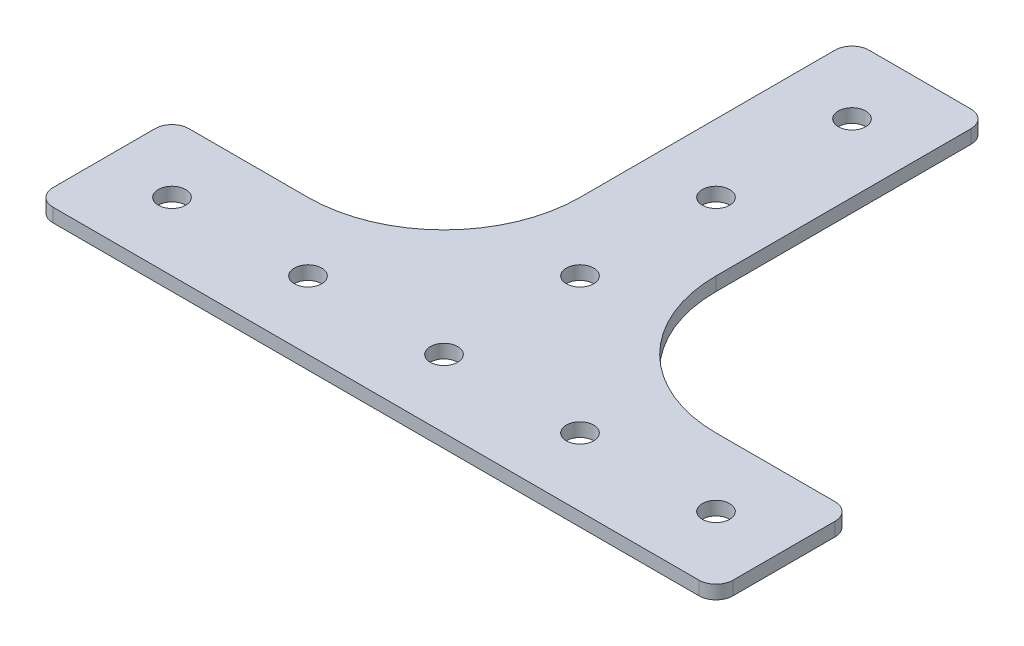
SolidWorks part; units mm, degrees
ref_plane "Front Plane" through (0, 0, 0) normal (0, 0, 1) x (1, 0, 0)
ref_plane "Top Plane" through (0, 0, 0) normal (0, 1, 0) x (1, 0, 0)
ref_plane "Right Plane" through (0, 0, 0) normal (1, 0, 0) x (0, 0, -1)
sketch "Sketch1" plane through (0, 0, 0) normal (0, 1, 0) x (1, 0, 0)
  line L0 (-63.5, 0) -> (63.5, 0)
  line L1 (-63.5, 0) -> (-63.5, 25.4)
  line L2 (-63.5, 25.4) -> (-12.7, 25.4)
  line L3 (-12.7, 25.4) -> (-12.7, 101.6)
  line L4 (-12.7, 101.6) -> (12.7, 101.6)
  line L5 (12.7, 101.6) -> (12.7, 25.4)
  line L6 (12.7, 25.4) -> (63.5, 25.4)
  line L7 (63.5, 25.4) -> (63.5, 0)
  point P4 (0, 0)
  dimension "D1" = 25.4
  dimension "D2" = 127
  dimension "D3" = 101.6
extrude "Boss-Extrude1" add sketch "Sketch1" along normal blind 2.54
fillet "Fillet1" radius 3.175 6 edges at (-63.5, 1.27, -25.4) (-12.7, 1.27, -101.6) (12.7, 1.27, -101.6) (63.5, 1.27, -25.4) (63.5, 1.27, 0) (-63.5, 1.27, 0)
hole_wizard "#7 (0.201) Diameter Hole1" positions "Sketch3" profile "Sketch4" hole size "#7" standard "ANSI Inch"
sketch "Sketch3" plane through (0, 2.54, 0) normal (0, 1, 0) x (1, 0, 0)
  line L0 (-60.325, 0) -> (60.325, 0) construction
  line L1 (60.325, 25.4) -> (12.7, 25.4) construction
  point P0 (0, 12.7)
  point P2 (25.4, 12.7)
  point P4 (50.8, 12.7)
  point P6 (-25.4, 12.7)
  point P8 (-50.8, 12.7)
  point P10 (0, 38.1)
  point P12 (0, 63.5)
  point P14 (0, 88.9)
  dimension "D1" = 12.7
  dimension "D2" = 12.7
  dimension "D3" = 25.4
  dimension "D4" = 25.4
  dimension "D5" = 25.4
  dimension "D6" = 25.4
  dimension "D7" = 25.4
  dimension "D8" = 25.4
sketch "Sketch4" plane through (0, 2.54, -12.7) normal (1, 0, 0) x (0, 0, 1)
  line L0 (0, 0) -> (0, 2.54)
  line L1 (0, 2.54) -> (2.5527, 2.54)
  line L2 (2.5527, 2.54) -> (2.5527, 0)
  line L5 (2.5527, 0) -> (0, 0)
  line L11 (0, -6.35) -> (0, 107.95) construction
  dimension "Thru Hole Dia." = 5.1054
  dimension "Thru Hole Depth" = 2.54
fillet "Fillet2" radius 25.4 2 edges at (-12.7, 1.27, -25.4) (12.7, 1.27, -25.4)
